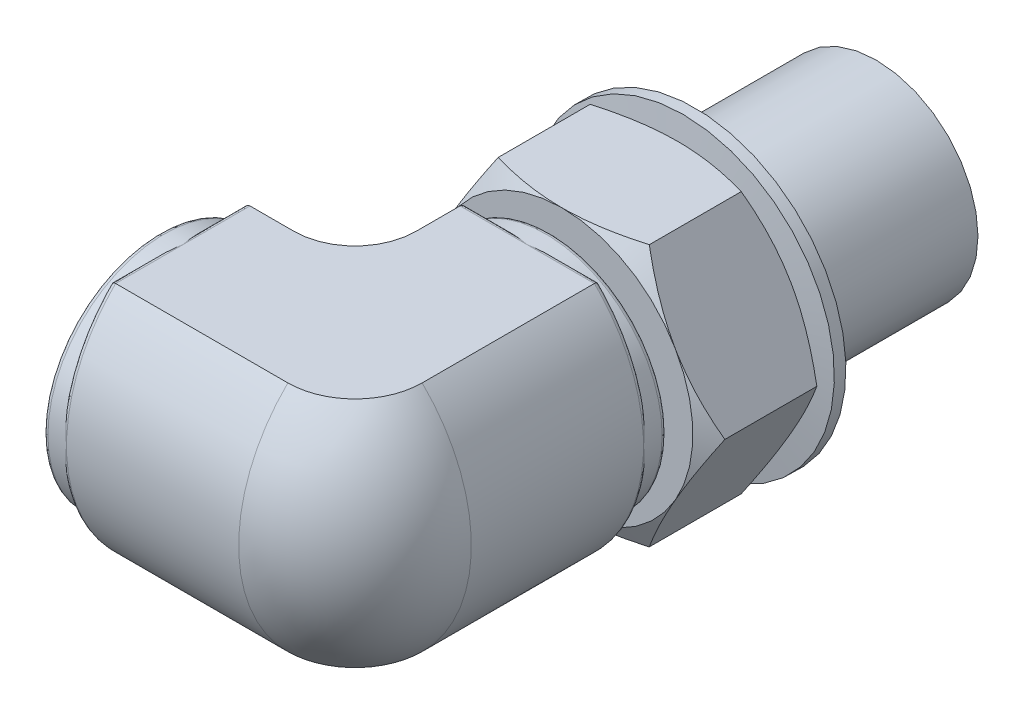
SolidWorks part; units mm, degrees
ref_plane "Front" through (0, 0, 0) normal (0, 0, 1) x (1, 0, 0)
ref_plane "Top" through (0, 0, 0) normal (0, 1, 0) x (1, 0, 0)
ref_plane "Right" through (0, 0, 0) normal (1, 0, 0) x (0, 0, -1)
imported_body "Imported1"
imported_body "Imported2"
sketch "Sketch1" plane through (17.78, 0, 0) normal (-1, 0, 0) x (0, 0, 1)
  circle A0 centre (0, 0) radius 12.5442
extrude "Cut-Extrude1" cut sketch "Sketch1" along normal through all
hole_wizard "1/8 NPT Tapped Hole1" positions "Sketch3" profile "Sketch2" size "1/8" standard "Ansi Inch"
sketch "Sketch3" plane through (17.78, 0, 0) normal (-1, 0, 0) x (0, 0, 1)
  point P0 (0, 0)
sketch "Sketch2" plane through (17.78, 0, 0) normal (0, 1, 0) x (0, 0, 1)
  line L0 (0, 0) -> (0, 15.2335)
  line L1 (4.2164, 12.7) -> (0, 15.2335)
  line L2 (-4.2164, 12.7) -> (0, 15.2335) construction
  line L3 (4.2164, 12.7) -> (4.2164, 9.652)
  line L4 (4.2164, 9.652) -> (4.5374, 9.652)
  line L5 (4.5374, 9.652) -> (4.8264, 0)
  line L6 (-4.5374, 9.652) -> (-4.8264, 0) construction
  line L7 (4.8264, 0) -> (0, 0)
  line L8 (0, -6.35) -> (0, 107.95) construction
  line L11 (-4.2164, 9.652) -> (-4.5374, 9.652) construction
  dimension "Tap Drill Dia." = 8.4328
  dimension "Tap Drill Depth" = 12.7
  dimension "Thread Dia." = 9.6528
  dimension "Thread Angle" = 3.43
  dimension "Thread Depth" = 9.652
  dimension "Drill Angle" = 118
equation "\"Buoyancy\"=\"SW-Volume\"*(\"SW-Density\"-.037062)"
